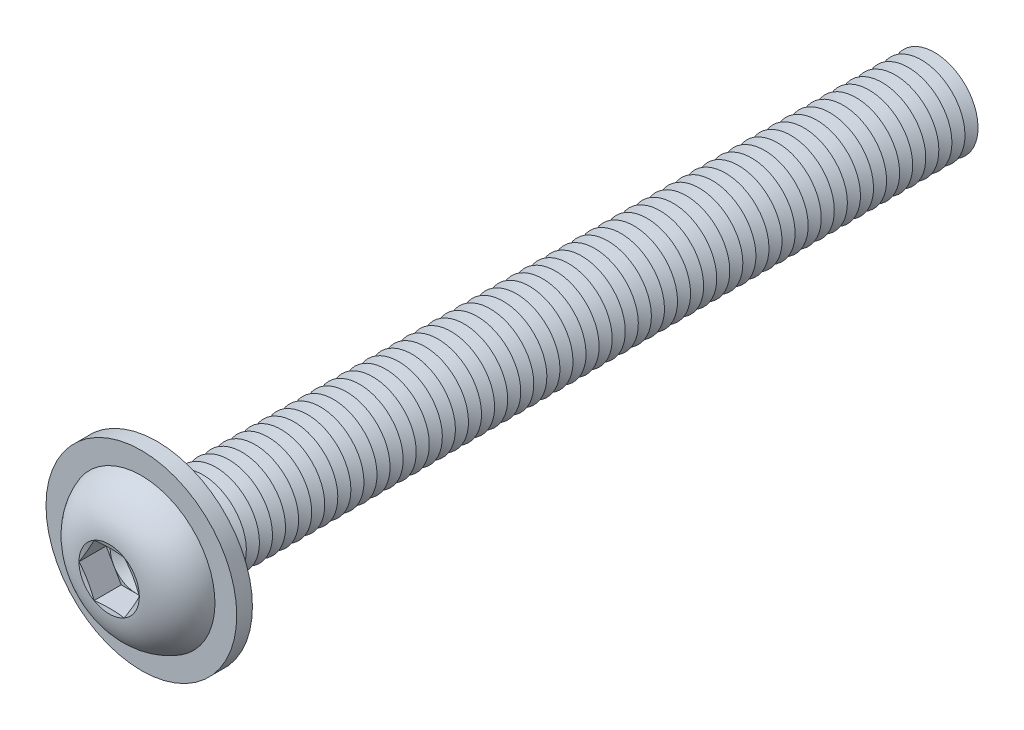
SolidWorks part; units mm, degrees
ref_plane "Front Plane" through (0, 0, 0) normal (0, 0, 1) x (1, 0, 0)
ref_plane "Top Plane" through (0, 0, 0) normal (0, 1, 0) x (1, 0, 0)
ref_plane "Right Plane" through (0, 0, 0) normal (1, 0, 0) x (0, 0, -1)
sketch "Sketch1" plane through (0, 0, 0) normal (1, 0, 0) x (0, 0, -1)
  line L0 (0, 5) -> (0, 8.75)
  line L3 (0, 5) -> (90, 5)
  line L4 (90, 5) -> (90, 0)
  line L5 (90, 0) -> (-5.5, 0) construction
  line L6 (-5.5, 0) -> (90, 0)
  line L7 (-5.5, 3.4641) -> (-5.5, 1.732) construction
  line L8 (-5.5, 1.732) -> (-5.5, 0)
  line L9 (-5.5, 3.4641) -> (-5.0359, 1.732)
  line L10 (-5.0359, 1.732) -> (-5.5, 1.732)
  line L11 (90, 0) -> (22.7481, 0) construction
  line L12 (0, 8.75) -> (-5.5, 8.75) construction
  arc A1 (0, 8.75) -> (-5.5, 3.4641) centre (0, 3.2457) ccw
  point P8 (90, 2.5)
  dimension "D1" = 17.5
  dimension "D2" = 10
  dimension "D3" = 5.5
  dimension "D4" = 6.9282
  dimension "D5" = 90
  dimension "D6" = 15
revolve "Revolve1" add sketch "Sketch1" angle 360 about L5
fillet "Fillet1" radius 0.75 1 edges at (0, 5, 0)
sketch "Sketch2" plane through (0, 0, 0) normal (1, 0, 0) x (0, 0, -1)
  line L0 (89.25, 5) -> (90.75, 5)
  line L1 (90, 5) -> (0.75, 5) construction
  line L2 (90.75, 5) -> (90, 3.701)
  line L3 (90, -5) -> (90, 5) construction
  line L4 (90, 3.701) -> (89.25, 5)
  dimension "D1" = 1.5
revolve "Cut-Revolve1" cut sketch "Sketch2" angle 360 about axis through (0, 0, -90) along (0, 0, -1)
pattern_linear "LPattern1" count 60 spacing 1.5 along (0, 0, 1) of "Cut-Revolve1"
sketch "Sketch3" plane through (0, 0, 5.5) normal (0, 0, 1) x (1, 0, 0)
  line L7 (1.732, 3) -> (-1.7321, 3)
  line L8 (-1.7321, 3) -> (-3.4641, 0)
  line L9 (-3.4641, 0) -> (-1.732, -3)
  line L10 (-1.732, -3) -> (1.732, -3)
  line L11 (1.732, -3) -> (3.4641, 0)
  line L12 (3.4641, 0) -> (1.732, 3)
  circle A0 centre (0, 0) radius 3 construction
  circle A3 centre (0, 0) radius 3.4641 construction
extrude "Cut-Extrude1" cut sketch "Sketch3" against normal blind 3.12
sketch "Sketch4" plane through (0, 0, 2.38) normal (0, 0, 1) x (1, 0, 0)
  line L1 (1.732, 3) -> (-1.7321, 3) construction
  circle A0 centre (0, 0) radius 3
extrude "Cut-Extrude2" cut sketch "Sketch4" against normal through all draft 60
sketch "Sketch5" plane through (0, 0, 0) normal (0, 0, -1) x (-1, 0, 0)
  circle A0 centre (0, 0) radius 10.95
  circle A1 centre (0, 0) radius 5.75
  circle A2 centre (0, 0) radius 5.75 construction
  dimension "D1" = 21.9
extrude "Boss-Extrude1" add sketch "Sketch5" against normal blind 1.8
